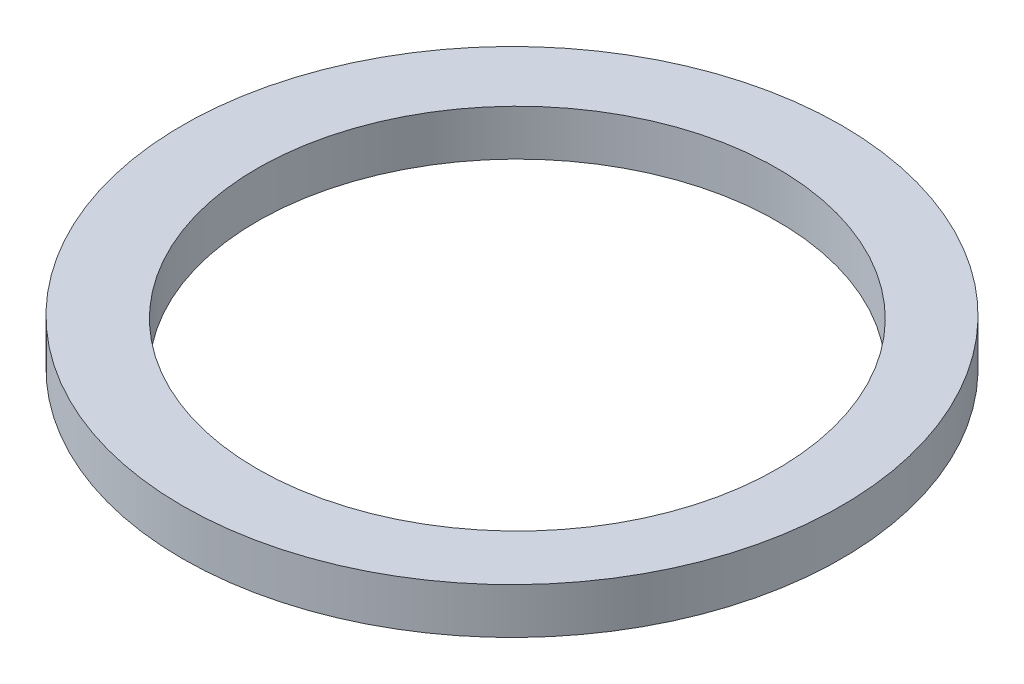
SolidWorks part; units mm, degrees
ref_plane "Front Plane" through (0, 0, 0) normal (0, 0, 1) x (1, 0, 0)
ref_plane "Top Plane" through (0, 0, 0) normal (0, 1, 0) x (1, 0, 0)
ref_plane "Right Plane" through (0, 0, 0) normal (1, 0, 0) x (0, 0, -1)
sketch "Sketch1" plane through (0, 0, 0) normal (0, 1, 0) x (1, 0, 0)
  circle A0 centre (0, 0) radius 12.065
  dimension "D1" = 24.13
extrude "Extrude1" add sketch "Sketch1" along normal blind 1.6764
sketch "Sketch2" plane through (0, 1.6764, 0) normal (0, 1, 0) x (-1, 0, 0)
  circle A0 centre (-0.1952, 0) radius 9.525
  dimension "D1" = 19.05
extrude "Cut-Extrude1" cut sketch "Sketch2" against normal blind 2.54
